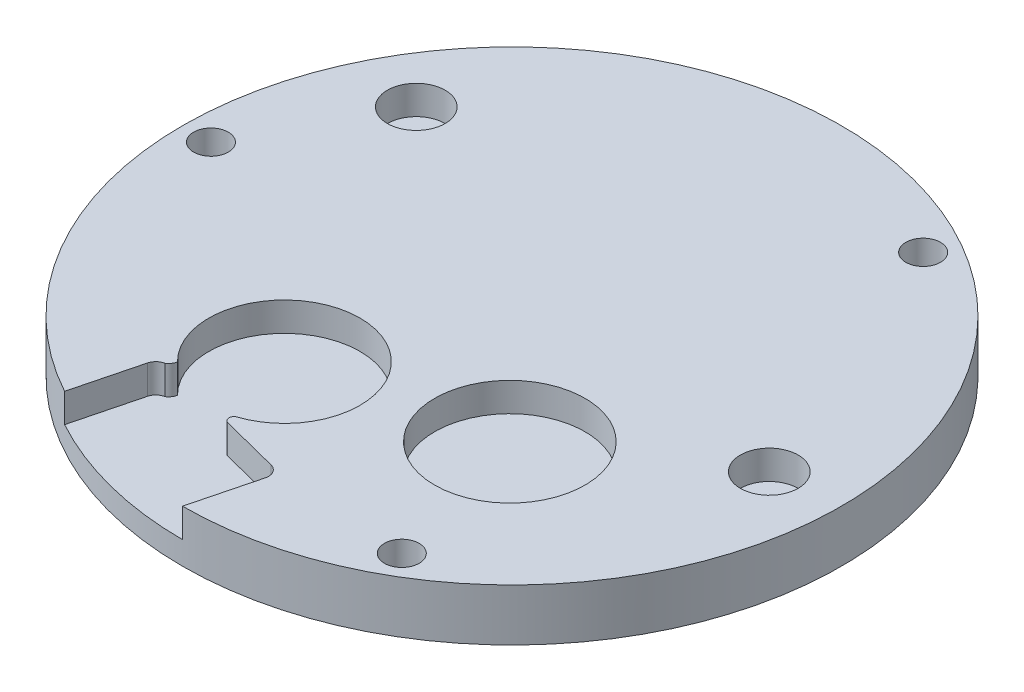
SolidWorks part; units mm, degrees
ref_plane "Front Plane" through (0, 0, 0) normal (0, 0, 1) x (1, 0, 0)
ref_plane "Top Plane" through (0, 0, 0) normal (0, 1, 0) x (1, 0, 0)
ref_plane "Right Plane" through (0, 0, 0) normal (1, 0, 0) x (0, 0, -1)
sketch "Base Sketch" plane through (0, 0, 0) normal (0, 1, 0) x (1, 0, 0)
  circle A0 centre (0, 0) radius 57
extrude "Main Body" add sketch "Base Sketch" along normal blind 9
sketch "Mounting Screw Pattern - Fixed" plane through (0, 9, 0) normal (0, 1, 0) x (1, 0, 0)
  circle A0 centre (26.6725, -43.7947) radius 3
  circle A1 centre (-51.2636, -1.2017) radius 3
  circle A2 centre (24.5911, 44.9964) radius 3
  point P2 (-50.9511, -1.5905)
  point P3 (26.6725, -43.7947)
  point P8 (0, 0)
  point P9 (0, 0)
  dimension "D1" = 3
extrude "Mounting Screw Holes" [suppressed] cut sketch "Mounting Screw Pattern - Fixed" against normal blind 8.5
sketch "Mounting Screw Pattern" [suppressed] plane through (0, 15, 0) normal (0, 1, 0) x (1, 0, 0)
  circle A5 centre (0, 52.3019) radius 3
  circle A6 centre (45.2948, -26.1509) radius 3
  circle A7 centre (-45.2948, -26.1509) radius 3
  dimension "D1" = 3
sketch "Tripod Hole" plane through (0, 0, 0) normal (0, -1, 0) x (-1, 0, 0)
  circle A0 centre (0, 0) radius 4.75
  circle A1 centre (0, 13.5283) radius 3.3454
extrude "Cut Tripod Hole" cut sketch "Tripod Hole" against normal blind 8
sketch "Outcroppings" plane through (0, 9, 0) normal (0, 1, 0) x (1, 0, 0)
  line L0 (1.4825, -43.1531) -> (-22.0471, -37.1257)
  line L3 (0, -57) -> (2.9236, -45.5869)
  line L4 (-27.4044, -49.98) -> (-24.4808, -38.5668)
  arc A0 (0, -57) -> (-27.4044, -49.98) centre (0, 0) cw
  circle A1 centre (0, 0) radius 57 construction
  arc A3 (2.9236, -45.5869) -> (1.4825, -43.1531) centre (0.9862, -45.0906) ccw
  circle A4 centre (45.5841, -1.0814) radius 5
  circle A5 centre (-39.5949, 23.0416) radius 5
  arc A6 (-24.4808, -38.5668) -> (-22.0471, -37.1257) centre (-22.5434, -39.0631) cw
  dimension "D1" = 2
extrude "Clear outcroppings" cut sketch "Outcroppings" against normal blind 5
sketch "Screw Pattern" plane through (0, 9, 0) normal (0, 1, 0) x (1, 0, 0)
  circle A3 centre (-52.0688, 0) radius 3
  circle A4 centre (26.0344, 45.0929) radius 3
  circle A5 centre (26.0344, -45.0929) radius 3
  point P2 (-52.0688, 0)
  dimension "D1" = 3
extrude "Cut Screw Holes" cut sketch "Screw Pattern" against normal blind 8
sketch "Rubber Grommets" plane through (0, 9, 0) normal (0, 1, 0) x (1, 0, 0)
  circle A0 centre (-12.8244, -26.5377) radius 13.0804
  circle A1 centre (18.6584, -19.0277) radius 13.0068
  point P0 (0, 0)
  point P16 (0, 0)
extrude "Cut Grommets" cut sketch "Rubber Grommets" against normal blind 5
sketch "Clean up pointy spots" plane through (0, 9, 0) normal (0, 1, 0) x (1, 0, 0)
  line L0 (1.4825, -43.1531) -> (-12.3509, -39.6095) construction
  line L1 (-8.4436, -40.6104) -> (-10.5829, -44.3564)
  line L2 (-10.5829, -44.3564) -> (-23.2268, -41.5745)
  line L3 (-23.2268, -41.5745) -> (-23.5624, -37.3422)
  line L4 (-22.045, -35.8154) -> (-19.4458, -34.3273)
  line L5 (-19.4458, -34.3273) -> (-8.3306, -36.7728)
  line L6 (-8.3306, -36.7728) -> (-8.4436, -38.8627)
  arc A0 (-8.4436, -38.8627) -> (-8.4436, -40.6104) centre (-8.3306, -39.7365) ccw
  arc A1 (-12.3509, -39.6095) -> (-19.5243, -37.7719) centre (-12.8244, -26.5377) ccw construction
  arc A2 (-23.5624, -37.3422) -> (-22.045, -35.8154) centre (-23.9023, -35.4871) ccw
  arc A3 (-22.0471, -37.1257) -> (-24.4808, -38.5668) centre (-22.5434, -39.0631) ccw construction
extrude "Depointify" cut sketch "Clean up pointy spots" against normal blind 5
